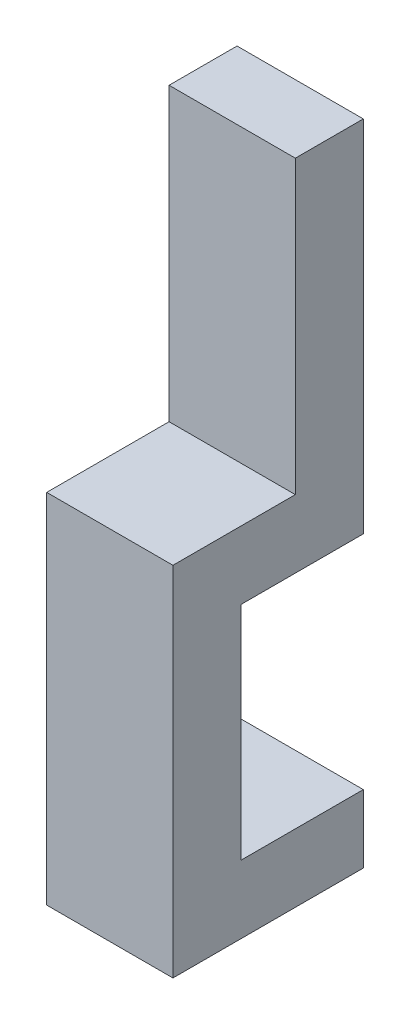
SolidWorks part; units mm, degrees
ref_plane "Front Plane" through (0, 0, 0) normal (0, 0, 1) x (1, 0, 0)
ref_plane "Top Plane" through (0, 0, 0) normal (0, 1, 0) x (1, 0, 0)
ref_plane "Right Plane" through (0, 0, 0) normal (1, 0, 0) x (0, 0, -1)
sketch "Sketch1" plane through (0, 0, 0) normal (1, 0, 0) x (0, 0, -1)
  line L1 (-46.7902, 5.1614) -> (-34.1902, 5.1614)
  line L2 (-46.7902, 5.1614) -> (-46.7902, -17.6386)
  line L3 (-46.7902, -17.6386) -> (-34.1902, -17.6386)
  line L4 (-34.1902, 12.1614) -> (-34.1902, 5.1614)
  line L5 (-53.7902, -24.6386) -> (-27.1902, -24.6386) construction
  line L6 (-41.7902, -24.6386) -> (-34.1902, -24.6386)
  line L7 (-53.7902, 0.1614) -> (-53.7902, -12.6386)
  line L8 (-34.1902, 5.1614) -> (-34.1902, -17.6386) construction
  line L9 (-53.7902, 12.1614) -> (-27.1902, 12.1614) construction
  line L10 (-27.1902, 12.1614) -> (-27.1902, -24.6386) construction
  line L11 (-34.1902, -17.6386) -> (-34.1902, -24.6386)
  line L12 (-53.7902, 12.1614) -> (-53.7902, -24.6386) construction
  line L13 (-53.7902, 0.1614) -> (-53.7902, 12.1614)
  line L14 (-53.7902, -12.6386) -> (-53.7902, -24.6386)
  line L15 (-41.7902, -24.6386) -> (-53.7902, -24.6386)
  line L16 (-41.1902, 12.1614) -> (-53.7902, 12.1614)
  line L17 (-41.1902, 12.1614) -> (-41.1902, 42.1614)
  line L18 (-41.1902, 42.1614) -> (-34.1902, 42.1614)
  line L19 (-34.1902, 42.1614) -> (-34.1902, 12.1614)
  point P9 (-40.4902, 5.1614)
  point P11 (-40.4902, -17.6386)
  dimension "D1" = 7
  dimension "D2" = 12.6
  dimension "D3" = 22.8
extrude "Boss-Extrude7" add sketch "Sketch1" along normal blind 13
